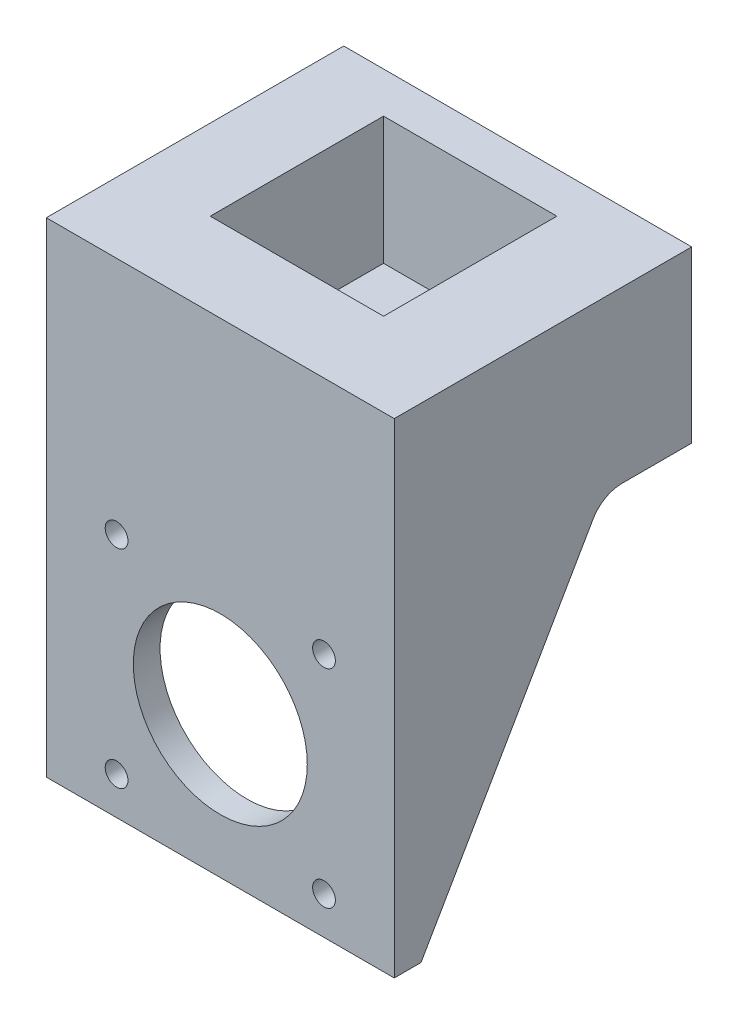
SolidWorks part; units mm, degrees
ref_plane "Front Plane" through (0, 0, 0) normal (0, 0, 1) x (1, 0, 0)
ref_plane "Top Plane" through (0, 0, 0) normal (0, 1, 0) x (1, 0, 0)
ref_plane "Right Plane" through (0, 0, 0) normal (1, 0, 0) x (0, 0, -1)
sketch "Sketch1" plane through (0, 0, 0) normal (0, 0, 1) x (1, 0, 0)
  line L1 (-41.91, -12.7) -> (41.91, -12.7)
  line L2 (-41.91, -12.7) -> (-41.91, 12.7)
  line L3 (-41.91, 12.7) -> (41.91, 12.7)
  line L4 (41.91, -12.7) -> (41.91, 12.7)
  line L5 (-41.91, -12.7) -> (41.91, 12.7) construction
  line L6 (-41.91, 12.7) -> (41.91, -12.7) construction
  point P0 (0, 0)
  dimension "D1" = 83.82
  dimension "D2" = 25.4
extrude "Boss-Extrude1" add sketch "Sketch1" along normal blind 6.35
sketch "Sketch3" plane through (0, 0, 6.35) normal (0, 0, 1) x (1, 0, 0)
  line L0 (41.91, -6.86) -> (41.91, -7.62)
  line L1 (-41.91, -6.86) -> (-41.91, -7.8218)
  line L2 (-41.4131, -6.6226) -> (-41.415, -6.71)
  line L3 (-40.3041, -6.6534) -> (-40.3058, -6.6983)
  line L6 (-40.8652, -6.1) -> (-40.8591, -6.1)
  line L7 (-38.8652, -6.1) -> (-38.8591, -6.1)
  line L12 (-39.4131, -6.6226) -> (-39.415, -6.71)
  line L13 (-38.3041, -6.6534) -> (-38.3058, -6.6983)
  line L14 (-37.4131, -6.6226) -> (-37.415, -6.71)
  line L15 (-36.8652, -6.1) -> (-36.8591, -6.1)
  line L16 (-34.8652, -6.1) -> (-34.8591, -6.1)
  line L17 (-32.8652, -6.1) -> (-32.8591, -6.1)
  line L18 (-30.8652, -6.1) -> (-30.8591, -6.1)
  line L19 (-28.8652, -6.1) -> (-28.8591, -6.1)
  line L20 (-26.8654, -6.1) -> (-26.8591, -6.1)
  line L21 (-24.8652, -6.1) -> (-24.8591, -6.1)
  line L27 (34.8591, -6.1) -> (34.8652, -6.1)
  line L28 (36.8591, -6.1) -> (36.8652, -6.1)
  line L29 (38.8591, -6.1) -> (38.8652, -6.1)
  line L30 (40.8591, -6.1) -> (40.8652, -6.1)
  line L32 (32.8652, -6.1) -> (29.456, -5.9831)
  line L33 (-41.91, -12.7) -> (41.91, -12.7) construction
  line L34 (41.91, -5.465) -> (29.4688, -5.465) construction
  line L35 (41.91, -12.7) -> (41.91, 12.7) construction
  line L38 (31.565, -7.82) -> (29.0504, -7.931)
  line L40 (-41.91, -7.8218) -> (-41.91, -8.0218)
  line L41 (-41.91, -8.0218) -> (-22.86, -8.0218)
  line L42 (-22.86, -7.8218) -> (-22.86, -8.0218)
  line L45 (31.565, -7.82) -> (41.91, -7.82)
  line L46 (41.91, -7.62) -> (41.91, -7.82)
  line L47 (22.1752, -12.7) -> (24.143, -12.7)
  line L390 (33.415, -6.6226) -> (33.4131, -6.6226)
  line L391 (33.415, -6.71) -> (33.415, -6.6226)
  line L392 (34.1562, -6.86) -> (33.565, -6.86)
  line L393 (34.3041, -6.6534) -> (34.3041, -6.6559)
  line L398 (35.415, -6.6226) -> (35.4131, -6.6226)
  line L399 (35.415, -6.71) -> (35.415, -6.6226)
  line L400 (36.1562, -6.86) -> (35.565, -6.86)
  line L401 (36.3041, -6.6534) -> (36.3041, -6.6559)
  line L406 (37.415, -6.6226) -> (37.4131, -6.6226)
  line L407 (37.415, -6.71) -> (37.415, -6.6226)
  line L408 (38.1562, -6.86) -> (37.565, -6.86)
  line L409 (38.3041, -6.6534) -> (38.3041, -6.6559)
  line L414 (39.415, -6.6226) -> (39.4131, -6.6226)
  line L415 (39.415, -6.71) -> (39.415, -6.6226)
  line L416 (40.1562, -6.86) -> (39.565, -6.86)
  line L417 (40.3041, -6.6534) -> (40.3041, -6.6559)
  line L422 (41.415, -6.6226) -> (41.4131, -6.6226)
  line L423 (41.415, -6.71) -> (41.415, -6.6226)
  line L424 (41.91, -6.86) -> (41.565, -6.86)
  line L1628 (0, -27.3539) -> (0, 27.3539) construction
  line L1698 (-41.91, -6.86) -> (-41.565, -6.86)
  line L1706 (-40.1562, -6.86) -> (-39.565, -6.86)
  line L1714 (-38.1562, -6.86) -> (-37.565, -6.86)
  line L1721 (-36.3041, -6.6534) -> (-36.3041, -6.6559)
  line L1722 (-36.1562, -6.86) -> (-35.565, -6.86)
  line L1723 (-35.415, -6.71) -> (-35.415, -6.6226)
  line L1724 (-35.415, -6.6226) -> (-35.4131, -6.6226)
  line L1729 (-34.3041, -6.6534) -> (-34.3041, -6.6559)
  line L1730 (-34.1562, -6.86) -> (-33.565, -6.86)
  line L1731 (-33.415, -6.71) -> (-33.415, -6.6226)
  line L1732 (-33.415, -6.6226) -> (-33.4131, -6.6226)
  line L1737 (-32.3041, -6.6534) -> (-32.3041, -6.6559)
  line L1738 (-32.1562, -6.86) -> (-31.565, -6.86)
  line L1739 (-31.415, -6.71) -> (-31.415, -6.6226)
  line L1740 (-31.415, -6.6226) -> (-31.4131, -6.6226)
  line L1745 (-30.3041, -6.6534) -> (-30.3041, -6.6559)
  line L1746 (-30.1562, -6.86) -> (-29.565, -6.86)
  line L1747 (-29.415, -6.71) -> (-29.415, -6.6226)
  line L1748 (-29.415, -6.6226) -> (-29.4131, -6.6226)
  line L1753 (-28.3041, -6.6534) -> (-28.3041, -6.6559)
  line L1754 (-28.1562, -6.86) -> (-27.565, -6.86)
  line L1755 (-27.415, -6.71) -> (-27.415, -6.6226)
  line L1756 (-27.415, -6.6226) -> (-27.4131, -6.6226)
  line L1761 (-26.3041, -6.6535) -> (-26.3041, -6.656)
  line L1762 (-26.1563, -6.86) -> (-25.5651, -6.8601)
  line L1763 (-25.4151, -6.7101) -> (-25.4151, -6.6226)
  line L1764 (-25.4151, -6.6226) -> (-25.4132, -6.6226)
  line L1769 (-24.3041, -6.6534) -> (-24.3041, -6.6549)
  line L1770 (-24.1562, -6.86) -> (-23.565, -6.86)
  line L1771 (-23.415, -6.71) -> (-23.415, -6.6226)
  line L1772 (-23.415, -6.6226) -> (-23.4131, -6.6226)
  line L1773 (-22.8652, -6.1) -> (-22.86, -7.3726)
  line L1774 (-22.86, -7.3726) -> (-22.86, -7.8218)
  arc A3 (29.456, -5.9831) -> (22.1752, -12.7) centre (28.9139, -12.7) ccw
  arc A5 (29.0504, -7.931) -> (24.143, -12.7) centre (28.9139, -12.7) ccw
  arc A235 (33.4131, -6.6226) -> (32.8652, -6.1) centre (32.8591, -6.655) ccw
  arc A236 (33.415, -6.71) -> (33.565, -6.86) centre (33.565, -6.71) ccw
  arc A237 (34.1562, -6.86) -> (34.3058, -6.6983) centre (34.1562, -6.71) ccw
  arc A238 (34.3041, -6.6559) -> (34.3058, -6.6983) centre (34.8591, -6.655) ccw
  arc A239 (34.8591, -6.1) -> (34.3041, -6.6534) centre (34.8591, -6.655) ccw
  arc A240 (35.4131, -6.6226) -> (34.8652, -6.1) centre (34.8591, -6.655) ccw
  arc A241 (35.415, -6.71) -> (35.565, -6.86) centre (35.565, -6.71) ccw
  arc A242 (36.1562, -6.86) -> (36.3058, -6.6983) centre (36.1562, -6.71) ccw
  arc A243 (36.3041, -6.6559) -> (36.3058, -6.6983) centre (36.8591, -6.655) ccw
  arc A244 (36.8591, -6.1) -> (36.3041, -6.6534) centre (36.8591, -6.655) ccw
  arc A245 (37.4131, -6.6226) -> (36.8652, -6.1) centre (36.8591, -6.655) ccw
  arc A246 (37.415, -6.71) -> (37.565, -6.86) centre (37.565, -6.71) ccw
  arc A247 (38.1562, -6.86) -> (38.3058, -6.6983) centre (38.1562, -6.71) ccw
  arc A248 (38.3041, -6.6559) -> (38.3058, -6.6983) centre (38.8591, -6.655) ccw
  arc A249 (38.8591, -6.1) -> (38.3041, -6.6534) centre (38.8591, -6.655) ccw
  arc A250 (39.4131, -6.6226) -> (38.8652, -6.1) centre (38.8591, -6.655) ccw
  arc A251 (39.415, -6.71) -> (39.565, -6.86) centre (39.565, -6.71) ccw
  arc A252 (40.1562, -6.86) -> (40.3058, -6.6983) centre (40.1562, -6.71) ccw
  arc A253 (40.3041, -6.6559) -> (40.3058, -6.6983) centre (40.8591, -6.655) ccw
  arc A254 (40.8591, -6.1) -> (40.3041, -6.6534) centre (40.8591, -6.655) ccw
  arc A255 (41.4131, -6.6226) -> (40.8652, -6.1) centre (40.8591, -6.655) ccw
  arc A256 (41.415, -6.71) -> (41.565, -6.86) centre (41.565, -6.71) ccw
  arc A1043 (-41.415, -6.71) -> (-41.565, -6.86) centre (-41.565, -6.71) cw
  arc A1044 (-41.4131, -6.6226) -> (-40.8652, -6.1) centre (-40.8591, -6.655) cw
  arc A1045 (-40.8591, -6.1) -> (-40.3041, -6.6534) centre (-40.8591, -6.655) cw
  arc A1047 (-40.1562, -6.86) -> (-40.3058, -6.6983) centre (-40.1562, -6.71) cw
  arc A1048 (-39.415, -6.71) -> (-39.565, -6.86) centre (-39.565, -6.71) cw
  arc A1049 (-39.4131, -6.6226) -> (-38.8652, -6.1) centre (-38.8591, -6.655) cw
  arc A1050 (-38.8591, -6.1) -> (-38.3041, -6.6534) centre (-38.8591, -6.655) cw
  arc A1052 (-38.1562, -6.86) -> (-38.3058, -6.6983) centre (-38.1562, -6.71) cw
  arc A1053 (-37.415, -6.71) -> (-37.565, -6.86) centre (-37.565, -6.71) cw
  arc A1054 (-37.4131, -6.6226) -> (-36.8652, -6.1) centre (-36.8591, -6.655) cw
  arc A1055 (-36.8591, -6.1) -> (-36.3041, -6.6534) centre (-36.8591, -6.655) cw
  arc A1056 (-36.3041, -6.6559) -> (-36.3058, -6.6983) centre (-36.8591, -6.655) cw
  arc A1057 (-36.1562, -6.86) -> (-36.3058, -6.6983) centre (-36.1562, -6.71) cw
  arc A1058 (-35.415, -6.71) -> (-35.565, -6.86) centre (-35.565, -6.71) cw
  arc A1059 (-35.4131, -6.6226) -> (-34.8652, -6.1) centre (-34.8591, -6.655) cw
  arc A1060 (-34.8591, -6.1) -> (-34.3041, -6.6534) centre (-34.8591, -6.655) cw
  arc A1061 (-34.3041, -6.6559) -> (-34.3058, -6.6983) centre (-34.8591, -6.655) cw
  arc A1062 (-34.1562, -6.86) -> (-34.3058, -6.6983) centre (-34.1562, -6.71) cw
  arc A1063 (-33.415, -6.71) -> (-33.565, -6.86) centre (-33.565, -6.71) cw
  arc A1064 (-33.4131, -6.6226) -> (-32.8652, -6.1) centre (-32.8591, -6.655) cw
  arc A1065 (-32.8591, -6.1) -> (-32.3041, -6.6534) centre (-32.8591, -6.655) cw
  arc A1066 (-32.3041, -6.6559) -> (-32.3058, -6.6983) centre (-32.8591, -6.655) cw
  arc A1067 (-32.1562, -6.86) -> (-32.3058, -6.6983) centre (-32.1562, -6.71) cw
  arc A1068 (-31.415, -6.71) -> (-31.565, -6.86) centre (-31.565, -6.71) cw
  arc A1069 (-31.4131, -6.6226) -> (-30.8652, -6.1) centre (-30.8591, -6.655) cw
  arc A1070 (-30.8591, -6.1) -> (-30.3041, -6.6534) centre (-30.8591, -6.655) cw
  arc A1071 (-30.3041, -6.6559) -> (-30.3058, -6.6983) centre (-30.8591, -6.655) cw
  arc A1072 (-30.1562, -6.86) -> (-30.3058, -6.6983) centre (-30.1562, -6.71) cw
  arc A1073 (-29.415, -6.71) -> (-29.565, -6.86) centre (-29.565, -6.71) cw
  arc A1074 (-29.4131, -6.6226) -> (-28.8652, -6.1) centre (-28.8591, -6.655) cw
  arc A1075 (-28.8591, -6.1) -> (-28.3041, -6.6534) centre (-28.8591, -6.655) cw
  arc A1076 (-28.3041, -6.6559) -> (-28.3058, -6.6983) centre (-28.8591, -6.655) cw
  arc A1077 (-28.1562, -6.86) -> (-28.3058, -6.6983) centre (-28.1562, -6.71) cw
  arc A1078 (-27.415, -6.71) -> (-27.565, -6.86) centre (-27.565, -6.71) cw
  arc A1079 (-27.4131, -6.6226) -> (-26.8654, -6.1) centre (-26.8591, -6.655) cw
  arc A1080 (-26.8591, -6.1) -> (-26.3041, -6.6535) centre (-26.8591, -6.655) cw
  arc A1081 (-26.3041, -6.656) -> (-26.3058, -6.6983) centre (-26.8591, -6.655) cw
  arc A1082 (-26.1563, -6.86) -> (-26.3058, -6.6983) centre (-26.1563, -6.71) cw
  arc A1083 (-25.4151, -6.7101) -> (-25.5651, -6.8601) centre (-25.5651, -6.7101) cw
  arc A1084 (-25.4132, -6.6226) -> (-24.8652, -6.1) centre (-24.8591, -6.655) cw
  arc A1085 (-24.8591, -6.1) -> (-24.3041, -6.6534) centre (-24.8591, -6.655) cw
  arc A1086 (-24.3041, -6.6549) -> (-24.3058, -6.6983) centre (-24.8591, -6.655) cw
  arc A1087 (-24.1562, -6.86) -> (-24.3058, -6.6983) centre (-24.1562, -6.71) cw
  arc A1088 (-23.415, -6.71) -> (-23.565, -6.86) centre (-23.565, -6.71) cw
  arc A1089 (-23.4131, -6.6226) -> (-22.8652, -6.1) centre (-22.8591, -6.655) cw
  point P24 (0, 0)
  dimension "D1" = 0.635
  dimension "D3" = 0.76
sketch "Sketch4" plane through (0, 0, 6.35) normal (0, 0, 1) x (1, 0, 0)
  line L1 (-26, -12.7) -> (26, -12.7)
  line L2 (-26, -12.7) -> (-26, 12.7)
  line L3 (-26, 12.7) -> (26, 12.7)
  line L4 (26, -12.7) -> (26, 12.7)
  line L5 (-26, -12.7) -> (26, 12.7) construction
  line L6 (-26, 12.7) -> (26, -12.7) construction
  point P0 (0, 0)
  dimension "D1" = 52
extrude "Boss-Extrude2" add sketch "Sketch4" along normal blind 44.45
sketch "Sketch5" plane through (0, 12.7, 0) normal (0, 1, 0) x (1, 0, 0)
  line L1 (-13.95, -38.35) -> (11.95, -38.35)
  line L2 (-13.95, -38.35) -> (-13.95, -12.45)
  line L3 (-13.95, -12.45) -> (11.95, -12.45)
  line L4 (11.95, -38.35) -> (11.95, -12.45)
  line L5 (-13.95, -38.35) -> (11.95, -12.45) construction
  line L6 (-13.95, -12.45) -> (11.95, -38.35) construction
  line L8 (-26, -50.8) -> (-26, -6.35) construction
  line L9 (26, -50.8) -> (-26, -50.8) construction
  point P0 (-1, -25.4)
  point P9 (-1, -25.4)
  dimension "D1" = 25
  dimension "D2" = 25.9
  dimension "D3" = 25.9
  dimension "D4" = 25.4
extrude "Cut-Extrude1" cut sketch "Sketch5" against normal blind 19.05
sketch "Sketch7" plane through (0, -6.35, 0) normal (0, 1, 0) x (1, 0, 0)
  line L2 (-13.95, -38.35) -> (11.95, -38.35) construction
  line L3 (-13.95, -12.45) -> (-13.95, -38.35) construction
  circle A0 centre (-1, -25.4) radius 3.429
  point P0 (-1, -25.4)
  dimension "D2" = 6.858
  dimension "D1" = 12.95
  dimension "D3" = 12.95
extrude "Cut-Extrude2" cut sketch "Sketch7" against normal through all
sketch "Sketch10" plane through (41.91, 0, 0) normal (1, 0, 0) x (0, 0, -1)
  line L0 (-6.35, -12.7) -> (-6.35, 12.7) construction
  line L1 (-6.35, 7.62) -> (1.65, 7.62)
  line L2 (-6.35, 7.62) -> (-6.35, 3.62)
  line L3 (-6.35, 3.62) -> (1.65, 3.62)
  line L4 (1.65, 7.62) -> (1.65, 3.62)
  line L5 (-6.35, 12.7) -> (0, 12.7) construction
  dimension "D1" = 8
  dimension "D2" = 4
  dimension "D3" = 5.08
extrude "Cut-Extrude3" cut sketch "Sketch10" against normal through all
extrude "Cut-Extrude4" cut sketch "Sketch3" against normal through all
sketch "Sketch11" plane through (0, 0, 0) normal (0, 0, -1) x (-1, 0, 0)
  line L1 (-41.91, 12.7) -> (41.91, 12.7)
  line L2 (-41.91, 12.7) -> (-41.91, -12.7)
  line L3 (-41.91, -12.7) -> (41.91, -12.7)
  line L4 (41.91, 12.7) -> (41.91, -12.7)
extrude "Boss-Extrude3" add sketch "Sketch11" along normal blind 2.54
sketch "Sketch12" plane through (0, 0, 50.8) normal (0, 0, 1) x (1, 0, 0)
  circle A0 centre (0, 0) radius 2.54
  dimension "D1" = 5.08
sketch "Sketch13" plane through (-41.91, 0, 0) normal (-1, 0, 0) x (0, 0, 1)
  line L1 (-2.54, 12.7) -> (6.35, 12.7)
  line L2 (-2.54, 12.7) -> (-2.54, -12.7)
  line L3 (-2.54, -12.7) -> (6.35, -12.7)
  line L4 (6.35, 12.7) -> (6.35, -12.7)
extrude "Cut-Extrude7" cut sketch "Sketch13" against normal through all
sketch "Sketch14" plane through (0, -12.7, 0) normal (0, -1, 0) x (1, 0, 0)
  line L0 (26, 50.8) -> (26, 6.35) construction
  line L1 (-26, 50.8) -> (26, 50.8)
  line L2 (-26, 50.8) -> (-26, 46.8)
  line L3 (-26, 46.8) -> (26, 46.8)
  line L4 (26, 50.8) -> (26, 46.8)
  dimension "D1" = 4
extrude "Boss-Extrude4" add sketch "Sketch14" along normal blind 47
sketch "Sketch18" plane through (-26, 0, 0) normal (-1, 0, 0) x (0, 0, 1)
  line L0 (46.8, -59.7) -> (46.8, -12.7)
  line L1 (46.8, -12.7) -> (19.6645, -12.7)
  line L2 (46.8, -12.7) -> (6.35, -12.7) construction
  line L3 (19.6645, -12.7) -> (46.8, -59.7)
  dimension "D1" = 30
extrude "Boss-Extrude7" add sketch "Sketch18" against normal blind 3
sketch "Sketch15" plane through (0, 0, 50.8) normal (0, 0, 1) x (1, 0, 0)
  line L0 (26, -59.7) -> (-26, -59.7) construction
  line L1 (0, 0) -> (0, -61.8296) construction
  circle A0 centre (-15.5, -54.05) radius 1.7
  circle A1 centre (-15.5, -23.05) radius 1.7
  circle A2 centre (15.5, -54.05) radius 1.7
  circle A3 centre (15.5, -23.05) radius 1.7
  dimension "D1" = 3.4
  dimension "D3" = 3.4
  dimension "D2" = 15.5
  dimension "D4" = 31
  dimension "D5" = 5.65
extrude "Cut-Extrude8" cut sketch "Sketch15" against normal through all
sketch "Sketch16" plane through (26, 0, 0) normal (1, 0, 0) x (0, 0, -1)
  line L0 (-46.8, -59.7) -> (-19.6645, -12.7)
  line L1 (-46.8, -12.7) -> (-6.35, -12.7) construction
  line L2 (-19.6645, -12.7) -> (-46.8, -12.7)
  line L3 (-46.8, -12.7) -> (-46.8, -59.7)
  dimension "D1" = 30
extrude "Boss-Extrude5" add sketch "Sketch16" against normal blind 3
sketch "Sketch19" plane through (0, 0, 50.8) normal (0, 0, 1) x (1, 0, 0)
  circle A0 centre (0, -38.55) radius 13
  circle A1 centre (-15.5, -23.05) radius 1.7 construction
  dimension "D2" = 26
  dimension "D1" = 15.5
extrude "Cut-Extrude9" cut sketch "Sketch19" against normal through all
fillet "Fillet3" radius 5 1 edges at (24.5, -12.7, 19.6645)
fillet "Fillet4" radius 5 1 edges at (-24.5, -12.7, 19.6645)
